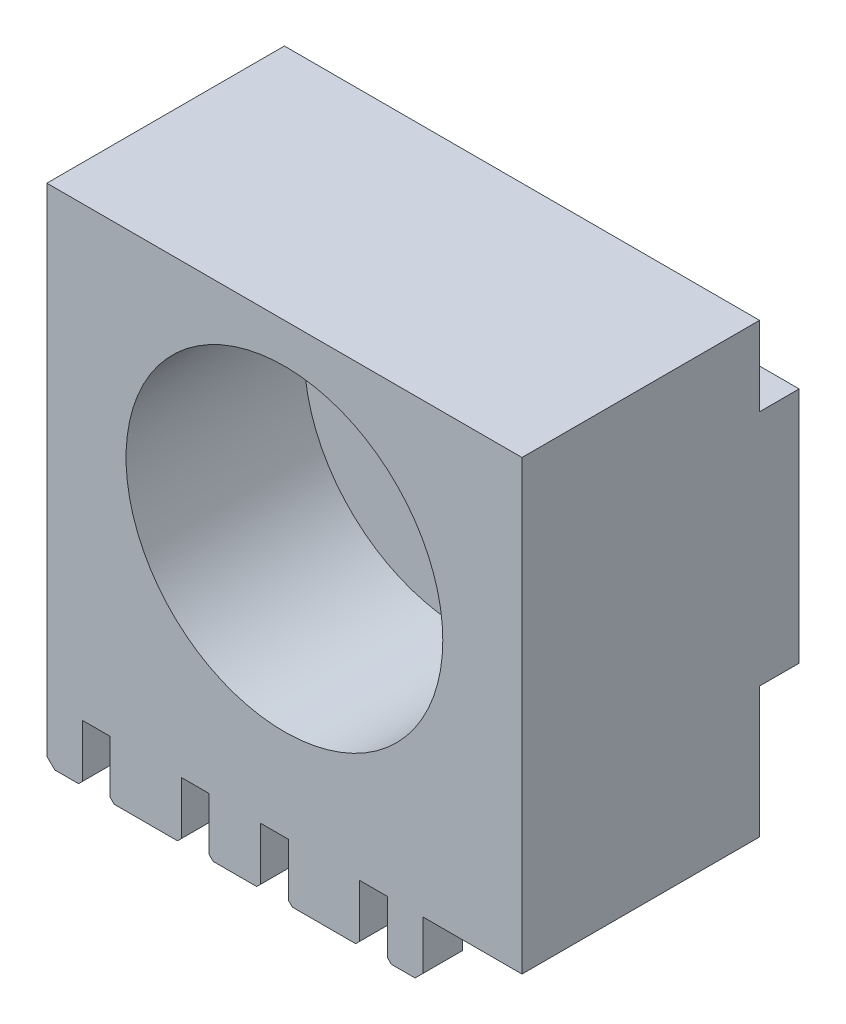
SolidWorks part; units mm, degrees
ref_plane "前视基准面" through (0, 0, 0) normal (0, 0, 1) x (1, 0, 0)
ref_plane "上视基准面" through (0, 0, 0) normal (0, 1, 0) x (1, 0, 0)
ref_plane "右视基准面" through (0, 0, 0) normal (1, 0, 0) x (0, 0, -1)
sketch "草图1" plane through (0, 0, 0) normal (0, 0, 1) x (1, 0, 0)
  line L0 (0, 12.735) -> (12, 12.735)
  line L1 (0.9, 1.435) -> (1.6, 1.435)
  line L2 (0.2, 0) -> (0.8, 0)
  line L3 (0, 0.2) -> (0, 12.735)
  line L4 (12, 1.435) -> (12, 12.735)
  line L5 (0.9, 0.1) -> (0.9, 1.435)
  line L6 (1.6, 0.1) -> (1.6, 1.435)
  line L7 (3.4, 0.1) -> (3.4, 1.435)
  line L8 (4.1, 0.1) -> (4.1, 1.435)
  line L9 (5.4, 0.1) -> (5.4, 1.435)
  line L10 (6.1, 0.1) -> (6.1, 1.435)
  line L11 (7.9, 0.1) -> (7.9, 1.435)
  line L12 (8.6, 0.1) -> (8.6, 1.435)
  line L13 (9.5, 0.2) -> (9.5, 1.435)
  line L14 (1.7, 0) -> (3.3, 0)
  line L15 (4.2, 0) -> (5.3, 0)
  line L16 (6.2, 0) -> (7.8, 0)
  line L17 (8.7, 0) -> (9.3, 0)
  line L18 (3.4, 1.435) -> (4.1, 1.435)
  line L19 (5.4, 1.435) -> (6.1, 1.435)
  line L20 (7.9, 1.435) -> (8.6, 1.435)
  line L21 (9.5, 1.435) -> (12, 1.435)
  line L22 (8.7, 0) -> (8.6, 0.1)
  line L23 (7.9, 0.1) -> (7.8, 0)
  line L24 (6.2, 0) -> (6.1, 0.1)
  line L25 (5.3, 0) -> (5.4, 0.1)
  line L26 (4.2, 0) -> (4.1, 0.1)
  line L27 (3.4, 0.1) -> (3.3, 0)
  line L28 (1.7, 0) -> (1.6, 0.1)
  line L29 (0.8, 0) -> (0.9, 0.1)
  line L30 (0.2, 0) -> (0, 0.2)
  line L31 (9.3, 0) -> (9.5, 0.2)
  circle A0 centre (6, 7.735) radius 2.25
extrude "凸台-拉伸1" add sketch "草图1" along normal blind 7
sketch "草图2" plane through (12, 0, 0) normal (1, 0, 0) x (0, 0, -1)
  line L0 (-7, 12.735) -> (-1, 12.735)
  line L1 (-6, 1.435) -> (-1, 1.435)
  line L2 (0, 4.735) -> (0, 10.735)
  line L3 (-1, 10.735) -> (0, 10.735)
  line L4 (-1, 4.735) -> (0, 4.735)
  line L5 (-7, 0) -> (-7, 12.735)
  line L6 (-1, 1.435) -> (-1, 4.735)
  line L7 (-1, 10.735) -> (-1, 12.735)
  line L8 (-6, 0) -> (-6, 1.435)
  line L9 (-6, 0) -> (-7, 0)
extrude "切除-拉伸1" cut sketch "草图2" against normal through all flip side to cut
sketch "草图3" plane through (0, 0, 7) normal (0, 0, 1) x (1, 0, 0)
  circle A0 centre (6, 7.735) radius 4
extrude "切除-拉伸2" cut sketch "草图3" against normal blind 4.5
